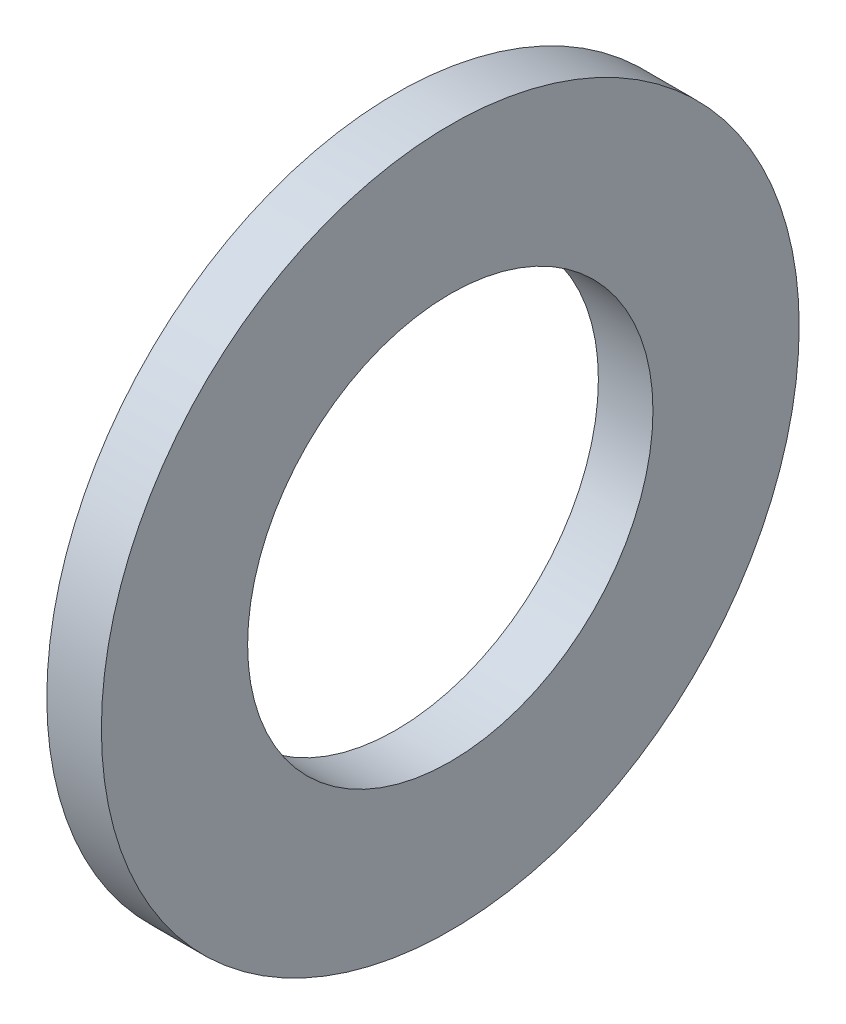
SolidWorks part; units mm, degrees
ref_plane "Front Plane" through (0, 0, 0) normal (0, 0, 1) x (1, 0, 0)
ref_plane "Top Plane" through (0, 0, 0) normal (0, 1, 0) x (1, 0, 0)
ref_plane "Right Plane" through (0, 0, 0) normal (1, 0, 0) x (0, 0, -1)
sketch "Sketch1" plane through (0, 0, 0) normal (1, 0, 0) x (0, 0, -1)
  circle A0 centre (0, 0) radius 9.7155
  circle A1 centre (0, 0) radius 16.7259
  dimension "OD" = 19.431
  dimension "ID" = 33.4518
extrude "Boss-Extrude1" add sketch "Sketch1" along normal blind 2.6162
